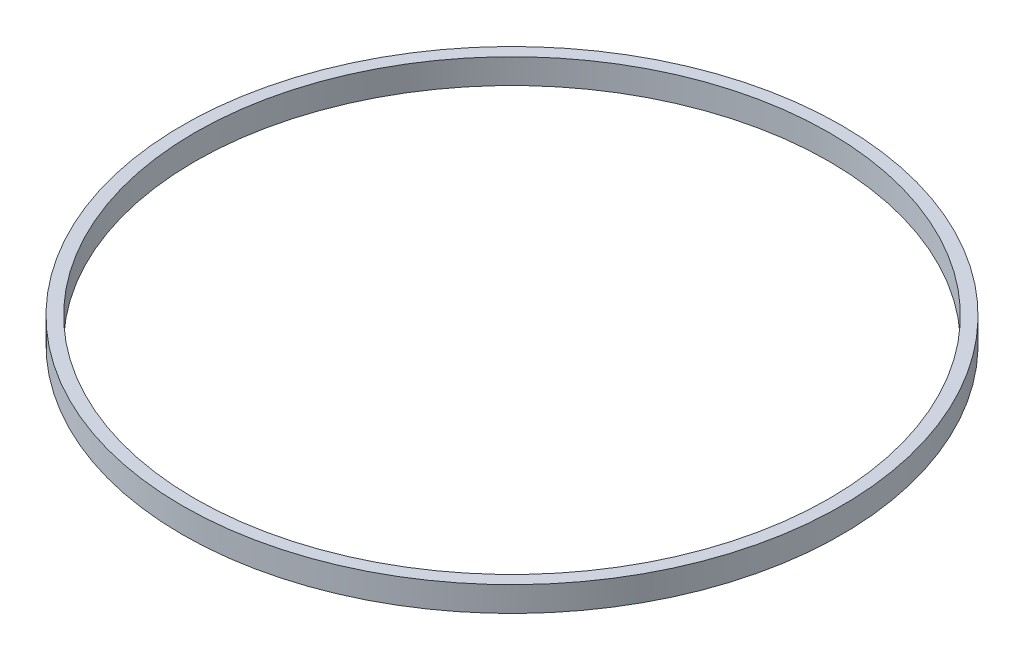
SolidWorks part; units mm, degrees
ref_plane "Front Plane" through (0, 0, 0) normal (0, 0, 1) x (1, 0, 0)
ref_plane "Top Plane" through (0, 0, 0) normal (0, 1, 0) x (1, 0, 0)
ref_plane "Right Plane" through (0, 0, 0) normal (1, 0, 0) x (0, 0, -1)
sketch "Sketch1" plane through (0, 0, 0) normal (0, 1, 0) x (1, 0, 0)
  circle A0 centre (0, 0) radius 12.7
  circle A1 centre (0, 0) radius 13.2
  dimension "D1" = 25.4
  dimension "D2" = 26.4
extrude "Boss-Extrude1" add sketch "Sketch1" along normal blind 1
